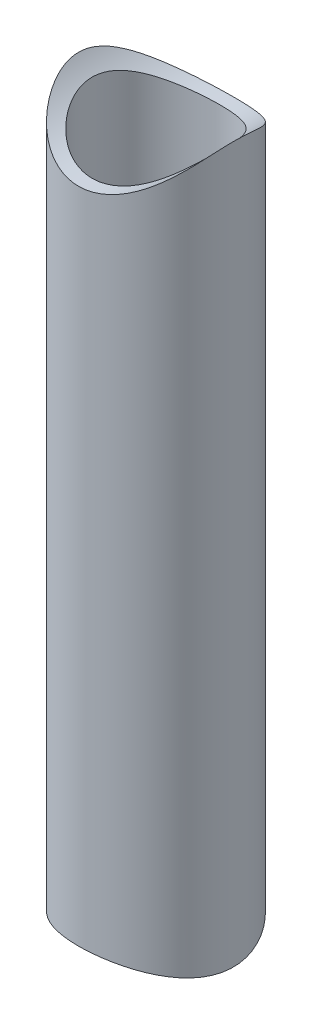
SolidWorks part; units mm, degrees
ref_plane "Front Plane" through (0, 0, 0) normal (0, 0, 1) x (1, 0, 0)
ref_plane "Top Plane" through (0, 0, 0) normal (0, 1, 0) x (1, 0, 0)
ref_plane "Right Plane" through (0, 0, 0) normal (1, 0, 0) x (0, 0, -1)
sketch "Sketch1" plane through (0, 0, 0) normal (0, 1, 0) x (1, 0, 0)
  circle A0 centre (0, 0) radius 12.7
  circle A1 centre (0, 0) radius 10.4648
  dimension "D1" = 25.4
  dimension "D2" = 2.2352
extrude "Boss-Extrude1" add sketch "Sketch1" against normal blind 152.4
sketch "Sketch2" plane through (0, 0, 0) normal (0, 0, 1) x (1, 0, 0)
  circle A0 centre (0, 0) radius 15.875
  dimension "D1" = 31.75
extrude "Cut-Extrude1" cut sketch "Sketch2" against normal mid plane 152.4
sketch "Sketch3" plane through (0, 0, 0) normal (0, 0, 1) x (1, 0, 0)
  line L0 (-12.7, -152.4) -> (12.7, -152.4) construction
  circle A0 centre (0, -152.4) radius 28.575
  dimension "D1" = 57.15
extrude "Cut-Extrude2" cut sketch "Sketch3" against normal mid plane 50.8
